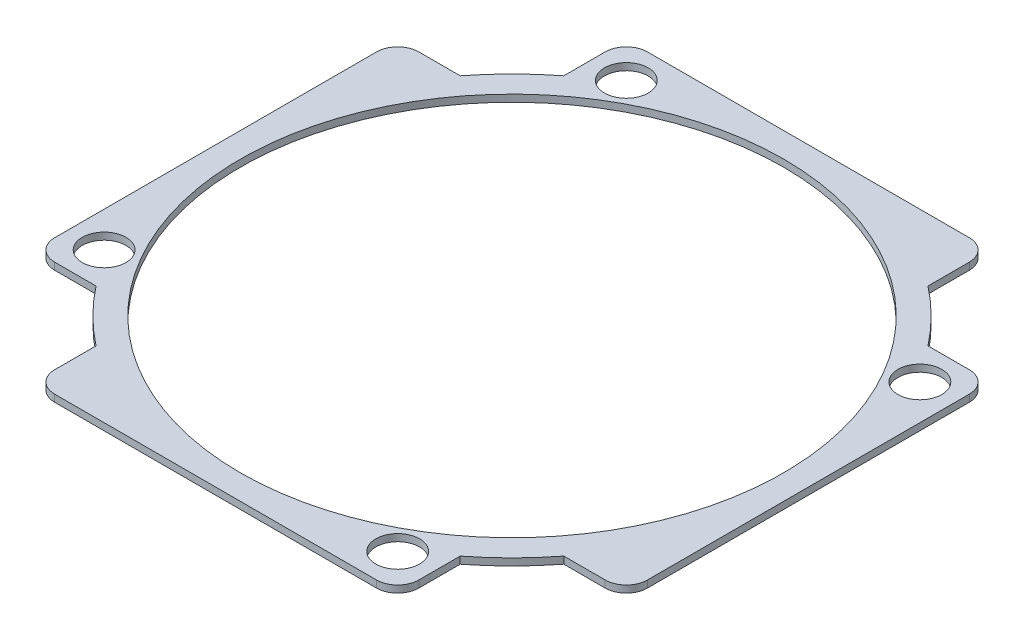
SolidWorks part; units mm, degrees
ref_plane "Front Plane" through (0, 0, 0) normal (0, 0, 1) x (1, 0, 0)
ref_plane "Top Plane" through (0, 0, 0) normal (0, 1, 0) x (1, 0, 0)
ref_plane "Right Plane" through (0, 0, 0) normal (1, 0, 0) x (0, 0, -1)
ref_plane "Plane1" through (0, 0.5, 0) normal (0, 1, 0) x (-1, 0, 0)
sketch "Sketch1" plane through (0, 0.5, 0) normal (0, 1, 0) x (-1, 0, 0)
  line L0 (11.4, 21) -> (-11.4, 21)
  line L1 (-12.9, 19.5) -> (-12.9, 16.5708)
  line L2 (-16.5708, 12.9) -> (-19.5, 12.9)
  line L3 (-21, 11.4) -> (-21, -11.4)
  line L4 (-19.5, -12.9) -> (-16.5708, -12.9)
  line L5 (-12.9, -16.5708) -> (-12.9, -19.5)
  line L6 (-11.4, -21) -> (11.4, -21)
  line L7 (12.9, -19.5) -> (12.9, -16.5708)
  line L8 (16.5708, -12.9) -> (19.5, -12.9)
  line L9 (21, -11.4) -> (21, 11.4)
  line L10 (19.5, 12.9) -> (16.5708, 12.9)
  line L11 (12.9, 16.5708) -> (12.9, 19.5)
  circle A0 centre (-18.5, -10.4) radius 1.55
  circle A1 centre (-10.4, 18.5) radius 1.55
  circle A2 centre (18.5, 10.4) radius 1.55
  circle A3 centre (10.4, -18.5) radius 1.55
  circle A4 centre (0, 0) radius 19.25
  arc A5 (-11.4, 21) -> (-12.9, 19.5) centre (-11.4, 19.5) ccw
  arc A6 (-12.9, 16.5708) -> (-16.5708, 12.9) centre (0, 0) ccw
  arc A7 (-19.5, 12.9) -> (-21, 11.4) centre (-19.5, 11.4) ccw
  arc A8 (-21, -11.4) -> (-19.5, -12.9) centre (-19.5, -11.4) ccw
  arc A9 (-16.5708, -12.9) -> (-12.9, -16.5708) centre (0, 0) ccw
  arc A10 (-12.9, -19.5) -> (-11.4, -21) centre (-11.4, -19.5) ccw
  arc A11 (11.4, -21) -> (12.9, -19.5) centre (11.4, -19.5) ccw
  arc A12 (12.9, -16.5708) -> (16.5708, -12.9) centre (0, 0) ccw
  arc A13 (19.5, -12.9) -> (21, -11.4) centre (19.5, -11.4) ccw
  arc A14 (21, 11.4) -> (19.5, 12.9) centre (19.5, 11.4) ccw
  arc A15 (16.5708, 12.9) -> (12.9, 16.5708) centre (0, 0) ccw
  arc A16 (12.9, 19.5) -> (11.4, 21) centre (11.4, 19.5) ccw
extrude "Boss-Extrude1" add sketch "Sketch1" against normal blind 0.5
